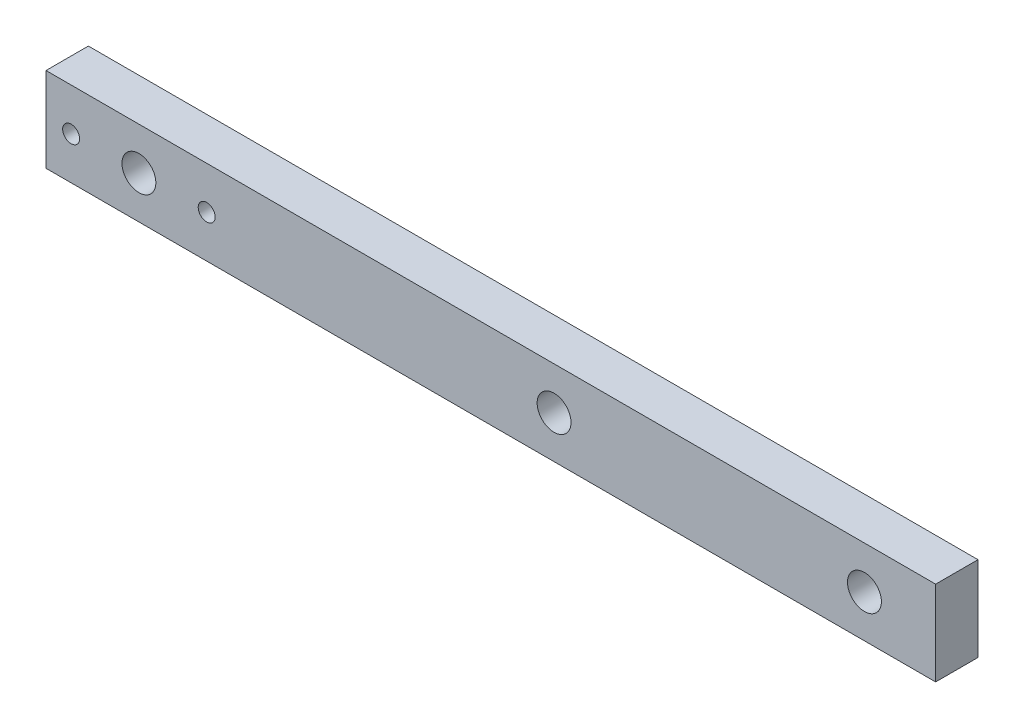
SolidWorks part; units mm, degrees
ref_plane "Front Plane" through (0, 0, 0) normal (0, 0, 1) x (1, 0, 0)
ref_plane "Top Plane" through (0, 0, 0) normal (0, 1, 0) x (1, 0, 0)
ref_plane "Right Plane" through (0, 0, 0) normal (1, 0, 0) x (0, 0, -1)
sketch "Sketch1" plane through (0, 0, 0) normal (0, 0, 1) x (1, 0, 0)
  line L1 (-55, 5) -> (50, 5)
  line L2 (-55, 5) -> (-55, -5)
  line L3 (-55, -5) -> (50, -5)
  line L4 (50, 5) -> (50, -5)
extrude "Boss-Extrude1" add sketch "Sketch1" along normal blind 5
sketch "Sketch2" plane through (0, 0, 5) normal (0, 0, 1) x (1, 0, 0)
  line L0 (-55, 5) -> (-55, -5) construction
  circle A0 centre (-44.0343, 0) radius 2
  circle A1 centre (-52.0343, 0) radius 1
  circle A2 centre (-36.0343, 0) radius 1
  circle A3 centre (41.5984, 0) radius 2
  circle A4 centre (4.9657, 0) radius 2
  dimension "D1" = 8
  dimension "D2" = 8
  dimension "D3" = 10.9657
  dimension "D5" = 49
  dimension "D6" = 36.6327
extrude "Cut-Extrude1" cut sketch "Sketch2" against normal blind 5
sketch "Sketch3" plane through (0, 0, 5) normal (0, 0, 1) x (1, 0, 0)
  line L0 (-55, 0) -> (50, 0)
  line L1 (-55, 5) -> (-55, -5) construction
  line L2 (50, -5) -> (50, 5) construction
